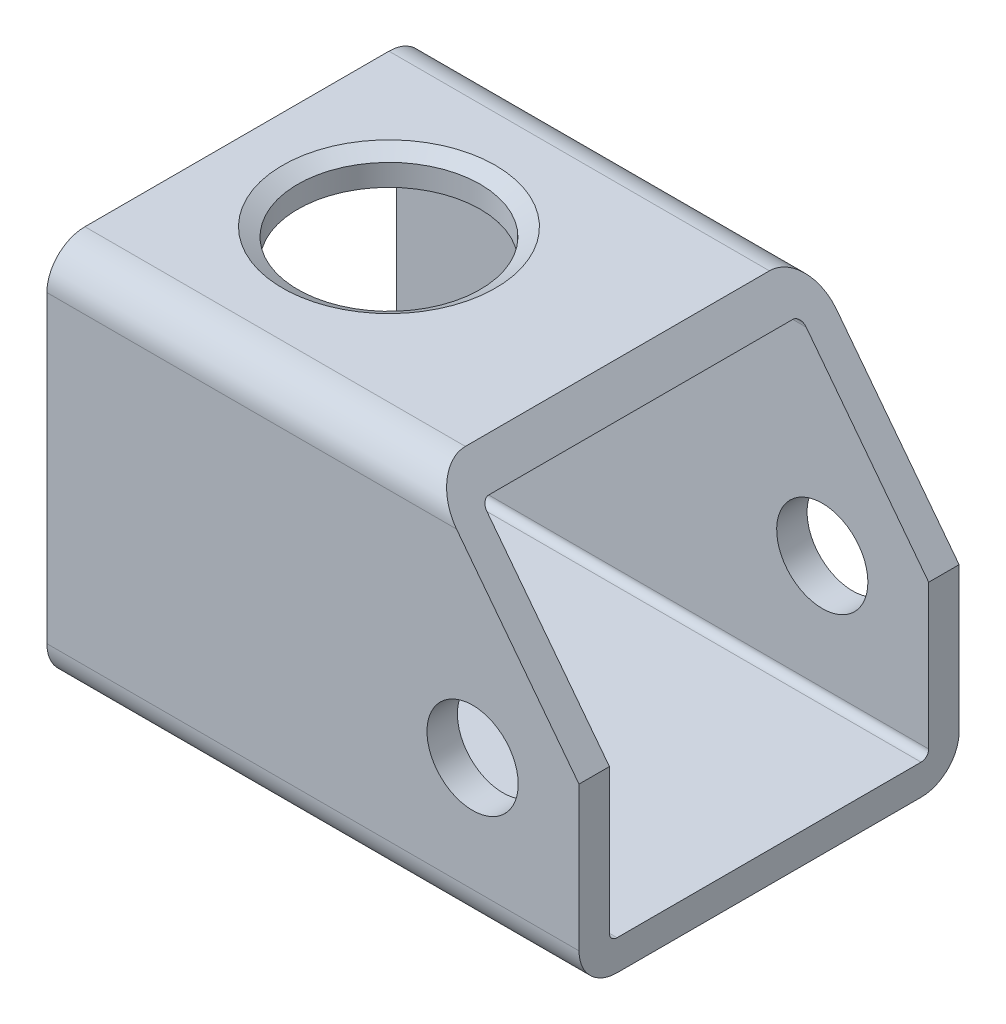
SolidWorks part; units mm, degrees
ref_plane "Plan de face" through (0, 0, 0) normal (0, 0, 1) x (1, 0, 0)
ref_plane "Plan de dessus" through (0, 0, 0) normal (0, 1, 0) x (1, 0, 0)
ref_plane "Plan de droite" through (0, 0, 0) normal (1, 0, 0) x (0, 0, -1)
sketch "Esquisse1" plane through (0, 0, 0) normal (1, 0, 0) x (0, 0, -1)
  line L0 (-10.5, 10) -> (-10.5, -10)
  line L1 (-10, 12.5) -> (10, 12.5)
  line L2 (-12.5, 10) -> (-12.5, -10)
  line L3 (-10, -12.5) -> (10, -12.5)
  line L4 (12.5, 10) -> (12.5, -10)
  line L5 (-12.5, 12.5) -> (12.5, -12.5) construction
  line L6 (-12.5, -12.5) -> (12.5, 12.5) construction
  line L7 (-10, -10.5) -> (10, -10.5)
  line L8 (10.5, 10) -> (10.5, -10)
  line L9 (-10, 10.5) -> (10, 10.5)
  line L10 (-10.5, 10.5) -> (-10.5, -10.5) construction
  line L11 (-10.5, -10.5) -> (10.5, -10.5) construction
  line L12 (10.5, 10.5) -> (10.5, -10.5) construction
  line L13 (-10.5, 10.5) -> (10.5, 10.5) construction
  line L14 (-12.5, 12.5) -> (-12.5, -12.5) construction
  line L15 (-12.5, -12.5) -> (12.5, -12.5) construction
  line L16 (12.5, 12.5) -> (12.5, -12.5) construction
  line L17 (-12.5, 12.5) -> (12.5, 12.5) construction
  arc A0 (-10.5, -10) -> (-10, -10.5) centre (-10, -10) ccw
  arc A1 (10, -10.5) -> (10.5, -10) centre (10, -10) ccw
  arc A2 (10.5, 10) -> (10, 10.5) centre (10, 10) ccw
  arc A3 (-10.5, 10) -> (-10, 10.5) centre (-10, 10) cw
  arc A4 (-12.5, -10) -> (-10, -12.5) centre (-10, -10) ccw
  arc A5 (10, -12.5) -> (12.5, -10) centre (10, -10) ccw
  arc A6 (10, 12.5) -> (12.5, 10) centre (10, 10) cw
  arc A7 (-10, 12.5) -> (-12.5, 10) centre (-10, 10) ccw
  point P0 (0, 0)
  dimension "D4" = 0.5
  dimension "D5" = 2.5
  dimension "D1" = 25
  dimension "D2" = 25
  dimension "D3" = 2
extrude "Boss.-Extru.1" add sketch "Esquisse1" along normal blind 35
sketch "Esquisse2" plane through (0, 0, 12.5) normal (0, 0, 1) x (1, 0, 0)
  line L0 (25.0247, 12.5) -> (35, -0.5)
  line L1 (35, 12.5) -> (0, 12.5) construction
  line L2 (35, 10) -> (35, -10) construction
  line L3 (35, -12.5) -> (0, -12.5) construction
  dimension "D1" = 37.5
  dimension "D2" = 12
extrude "Enlèv. mat.-Extru.1" cut sketch "Esquisse2" against normal through all and the other way through all
sketch "Esquisse3" plane through (0, 0, 12.5) normal (0, 0, 1) x (1, 0, 0)
  line L0 (35, -0.5) -> (35, -10) construction
  line L1 (35, -12.5) -> (0, -12.5) construction
  circle A0 centre (28, -2.5) radius 3
  dimension "D1" = 6
  dimension "D2" = 7
  dimension "D3" = 10
extrude "Enlèv. mat.-Extru.2" cut sketch "Esquisse3" against normal through all
sketch "Esquisse4" plane through (0, 12.5, 0) normal (0, 1, 0) x (1, 0, 0)
  line L0 (0, 10) -> (0, -10) construction
  circle A0 centre (10, 0) radius 6
  dimension "D1" = 12
  dimension "D2" = 10
extrude "Enlèv. mat.-Extru.3" cut sketch "Esquisse4" against normal up to next
chamfer "Chanfrein1" distance 1 angle 30 1 edges at (10, 12.5, 6)
